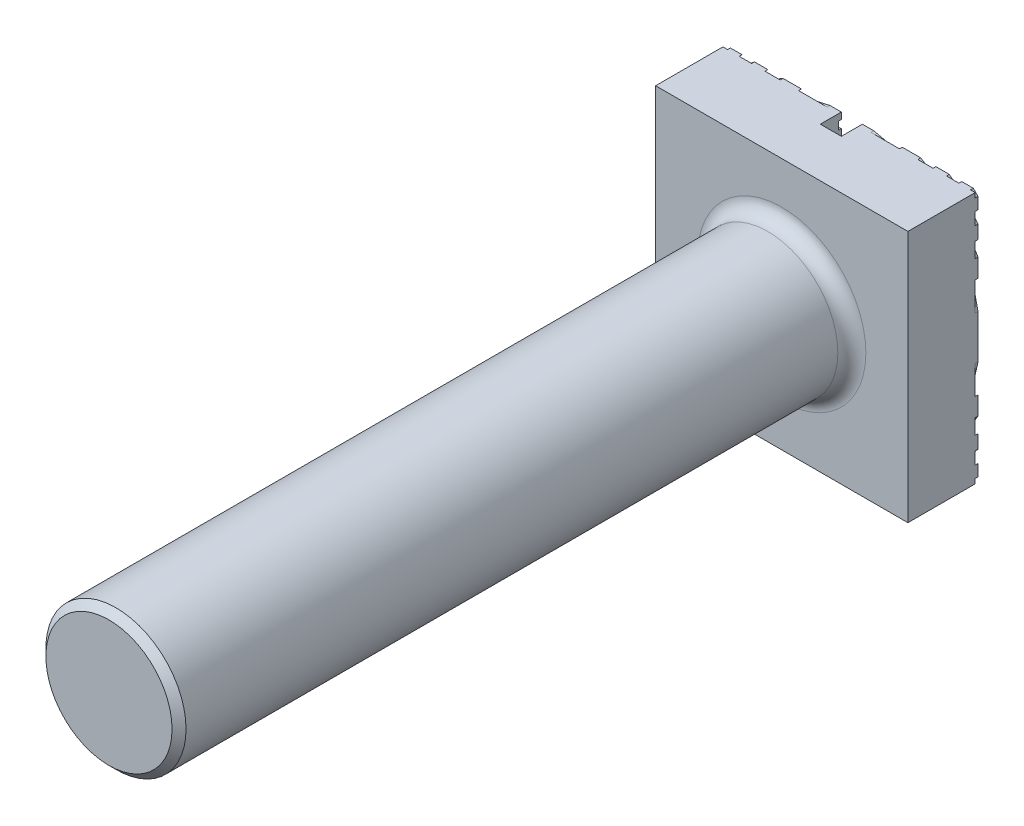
SolidWorks part; units mm, degrees
ref_plane "Plan de face" through (0, 0, 0) normal (0, 0, 1) x (1, 0, 0)
ref_plane "Plan de dessus" through (0, 0, 0) normal (0, 1, 0) x (1, 0, 0)
ref_plane "Plan de droite" through (0, 0, 0) normal (1, 0, 0) x (0, 0, -1)
sketch "Esquisse1" plane through (0, 0, 0) normal (0, 0, 1) x (1, 0, 0)
  line L0 (0, 78.0989) -> (0, -87.4707) construction
  line L1 (-103.9583, 0) -> (99.4459, 0) construction
  line L3 (-9, 9) -> (9, 9)
  line L4 (-9, 9) -> (-9, -9)
  line L5 (-9, -9) -> (9, -9)
  line L6 (9, 9) -> (9, -9)
  dimension "D1" = 18
  dimension "D2" = 18
extrude "Extrusion1" add sketch "Esquisse1" against normal blind 5
sketch "Esquisse2" plane through (0, 0, 0) normal (0, 0, 1) x (1, 0, 0)
  circle A0 centre (0, 0) radius 5
  dimension "D1" = 10
extrude "Extrusion2" add sketch "Esquisse2" along normal blind 48
fillet "Congé1" radius 1 1 edges at (5, 0, 0)
sketch "Esquisse3" plane through (0, -9, 0) normal (0, -1, 0) x (1, 0, 0)
  line L0 (0, 0) -> (0, -5) construction
  line L1 (-9, -5) -> (9, -5) construction
  line L3 (-0.75, -3.5) -> (0.75, -3.5)
  line L4 (-0.75, -3.5) -> (-0.75, -5)
  line L5 (-0.75, -5) -> (0.75, -5)
  line L6 (0.75, -3.5) -> (0.75, -5)
  dimension "D1" = 1.5
  dimension "D2" = 1.5
extrude "Enlèv. mat.-Extru.1" cut sketch "Esquisse3" against normal through all
sketch "Esquisse4" plane through (0, 0, -5) normal (0, 0, -1) x (-1, 0, 0)
  circle A0 centre (0, 0) radius 1.5
  circle A1 centre (0, 0) radius 2
  dimension "D1" = 3
  dimension "D2" = 4
extrude "Enlèv. mat.-Extru.2" cut sketch "Esquisse4" against normal blind 0.2
sketch "Esquisse6" plane through (0, 0, 0) normal (1, 0, 0) x (0, 0, -1)
  line L0 (4.8, 1.299) -> (5, 1.299)
  line L1 (5, 1.299) -> (5, 1.854)
  line L2 (4.8, 1.854) -> (4.8, 1.299)
  line L3 (5, 4.094) -> (4.8, 4.094)
  line L4 (5, 4.094) -> (5, 3.534)
  line L5 (5, 1.854) -> (4.8, 1.854)
  line L6 (5, 3.534) -> (4.8, 3.534)
  line L7 (4.8, 4.094) -> (4.8, 3.534)
  line L8 (5, 5.214) -> (4.8, 5.214)
  line L9 (5, 5.214) -> (5, 4.654)
  line L10 (5, 4.654) -> (4.8, 4.654)
  line L11 (4.8, 5.214) -> (4.8, 4.654)
  line L12 (5, 6.334) -> (4.8, 6.334)
  line L13 (5, 6.334) -> (5, 5.774)
  line L14 (5, 5.774) -> (4.8, 5.774)
  line L15 (4.8, 6.334) -> (4.8, 5.774)
  line L16 (5, 7.454) -> (4.8, 7.454)
  line L17 (5, 7.454) -> (5, 6.894)
  line L18 (5, 6.894) -> (4.8, 6.894)
  line L19 (4.8, 7.454) -> (4.8, 6.894)
  line L20 (5, 8.574) -> (4.8, 8.574)
  line L21 (5, 8.574) -> (5, 8.014)
  line L22 (5, 8.014) -> (4.8, 8.014)
  line L23 (4.8, 8.574) -> (4.8, 8.014)
  line L24 (5, 2.974) -> (4.8, 2.974)
  line L25 (5, 2.974) -> (5, 2.414)
  line L26 (5, 2.414) -> (4.8, 2.414)
  line L27 (4.8, 2.974) -> (4.8, 2.414)
  line L28 (5, 9.694) -> (4.8, 9.694)
  line L29 (5, 9.694) -> (5, 9.134)
  line L30 (5, 9.134) -> (4.8, 9.134)
  line L31 (4.8, 9.694) -> (4.8, 9.134)
  line L32 (5, 10.814) -> (4.8, 10.814)
  line L33 (5, 10.814) -> (5, 10.254)
  line L34 (5, 10.254) -> (4.8, 10.254)
  line L35 (4.8, 10.814) -> (4.8, 10.254)
  line L36 (5, 11.934) -> (4.8, 11.934)
  line L37 (5, 11.934) -> (5, 11.374)
  line L38 (5, 11.374) -> (4.8, 11.374)
  line L39 (4.8, 11.934) -> (4.8, 11.374)
  line L40 (5, 13.054) -> (4.8, 13.054)
  line L41 (5, 13.054) -> (5, 12.494)
  line L42 (5, 12.494) -> (4.8, 12.494)
  line L43 (4.8, 13.054) -> (4.8, 12.494)
  line L44 (5, 9) -> (5, 1.854) construction
  line L45 (0, 0) -> (15.7248, 0) construction
  line L48 (5, 1.299) -> (4.8, 1.299) construction
  dimension "D1" = 0.2
  dimension "D2" = 0.56
  dimension "D3" = 0.56
  dimension "D4" = 0.56
  dimension "D5" = 0.56
  dimension "D6" = 0.56
  dimension "D7" = 0.56
  dimension "D8" = 0.56
  dimension "D9" = 0.56
  dimension "D10" = 0.56
  dimension "D11" = 0.56
  dimension "D12" = 0.56
  dimension "D13" = 0.56
  dimension "D14" = 0.56
  dimension "D15" = 0.56
  dimension "D16" = 0.56
  dimension "D17" = 0.56
  dimension "D18" = 0.56
  dimension "D19" = 0.56
  dimension "D20" = 0.56
  dimension "D21" = 0.56
  dimension "D22" = 0.555
revolve "Enlèvement de matière-Révolution2" cut sketch "Esquisse6" angle 360 about L45
chamfer "Chanfrein1" distance 0.5 angle 45 1 edges at (5, 0, 48)
